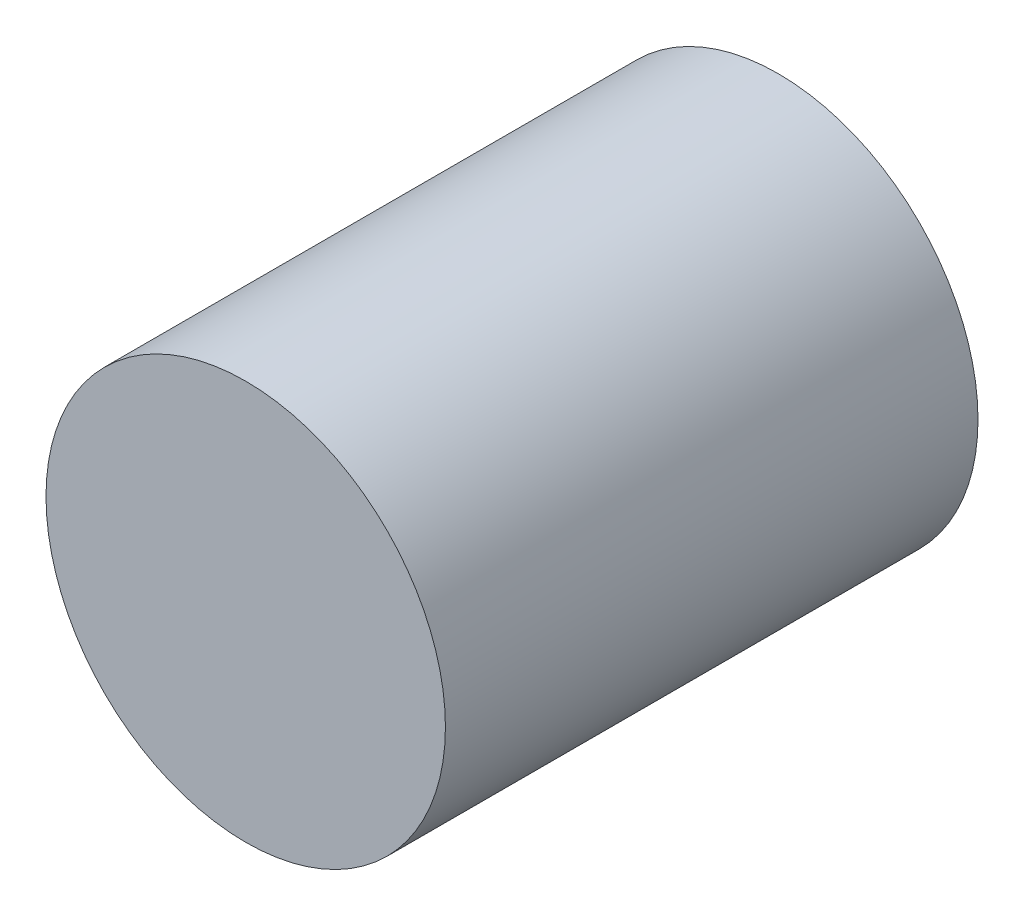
SolidWorks part; units mm, degrees
ref_plane "Front" through (0, 0, 0) normal (0, 0, 1) x (1, 0, 0)
ref_plane "Top" through (0, 0, 0) normal (0, 1, 0) x (1, 0, 0)
ref_plane "Right" through (0, 0, 0) normal (1, 0, 0) x (0, 0, -1)
sketch "Sketch1" plane through (0, 0, 0) normal (0, 0, 1) x (1, 0, 0)
  circle A0 centre (0, 0) radius 4.7625
  dimension "D1" = 9.525
extrude "Base-Extrude" add sketch "Sketch1" along normal blind 12.7
